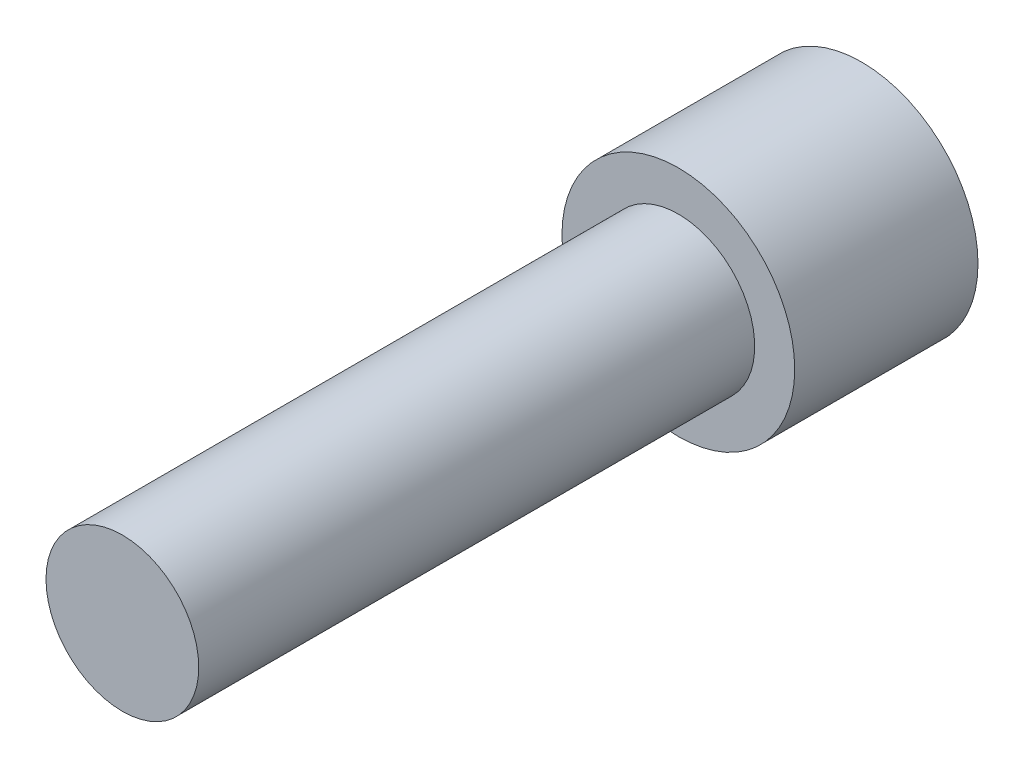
SolidWorks part; units mm, degrees
ref_plane "Alzado" through (0, 0, 0) normal (0, 0, 1) x (1, 0, 0)
ref_plane "Planta" through (0, 0, 0) normal (0, 1, 0) x (1, 0, 0)
ref_plane "Vista lateral" through (0, 0, 0) normal (1, 0, 0) x (0, 0, -1)
sketch "Croquis1" plane through (0, 0, 0) normal (0, 0, 1) x (1, 0, 0)
  circle A0 centre (0, 0) radius 12.5
extrude "Extruir1" add sketch "Croquis1" along normal blind 91
sketch "Croquis2" plane through (0, 0, 0) normal (0, 0, -1) x (-1, 0, 0)
  circle A0 centre (0, 0) radius 19.05
extrude "Extruir2" add sketch "Croquis2" along normal blind 30
sketch "Croquis3" plane through (0, 0, -30) normal (0, 0, -1) x (-1, 0, 0)
  circle A0 centre (0, 0) radius 6
extrude "Cortar-Extruir1" cut sketch "Croquis3" against normal blind 20
sketch "Croquis4" plane through (0, 0, 91) normal (0, 0, 1) x (1, 0, 0)
  circle A0 centre (0, 0) radius 5
sketch "Croquis5" plane through (0, 0, -30) normal (0, 0, -1) x (-1, 0, 0)
  line L0 (6, 0) -> (19.05, 0) construction
  line L1 (0, 0) -> (0, 17.3059) construction
  circle A0 centre (0, 0) radius 19.05 construction
  circle A1 centre (0, 0) radius 6 construction
  circle A2 centre (12.525, 0) radius 2.375
  circle A3 centre (-12.525, 0) radius 2.375
extrude "Cortar-Extruir3" cut sketch "Croquis5" against normal blind 15
